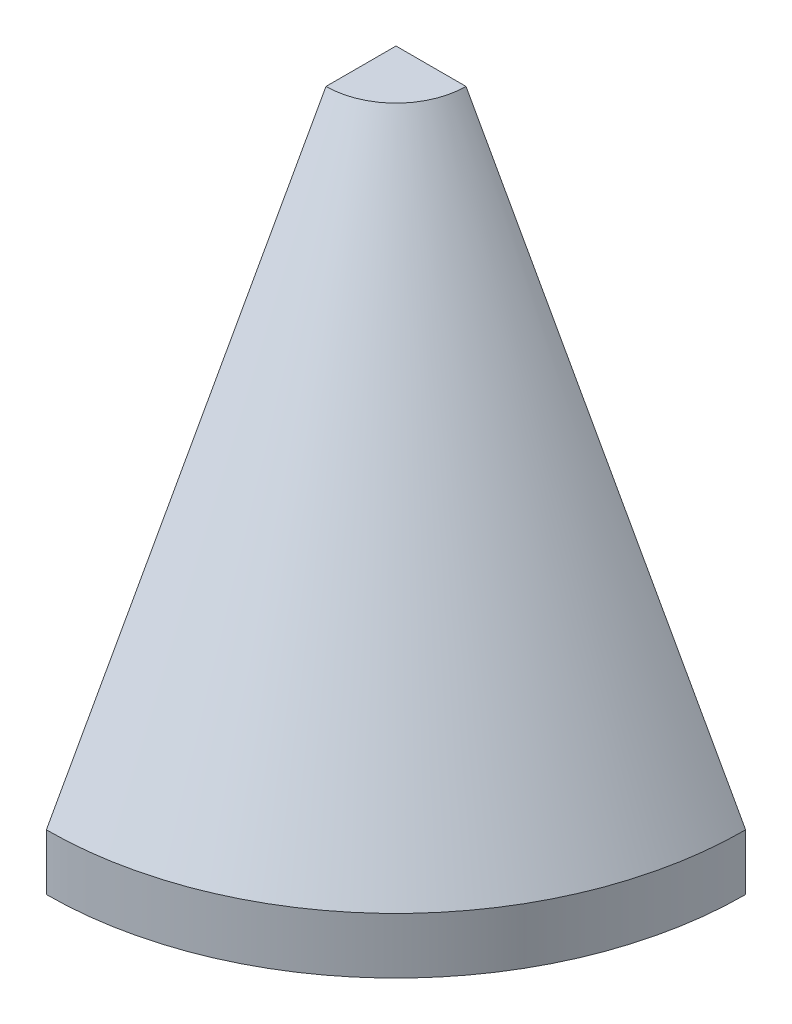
SolidWorks part; units mm, degrees
ref_plane "Front Plane" through (0, 0, 0) normal (0, 0, 1) x (1, 0, 0)
ref_plane "Top Plane" through (0, 0, 0) normal (0, 1, 0) x (1, 0, 0)
ref_plane "Right Plane" through (0, 0, 0) normal (1, 0, 0) x (0, 0, -1)
sketch "Sketch1" plane through (0, 0, 0) normal (0, 0, 1) x (1, 0, 0)
  line L0 (25, 200) -> (124.8798, 20)
  line L1 (0, 0) -> (124.8798, 0)
  line L2 (0, 0) -> (0, 200)
  line L3 (0, 200) -> (25, 200)
  line L4 (124.8798, 0) -> (124.8798, 20)
  dimension "D1" = 124.8798
  dimension "D2" = 20
  dimension "D3" = 25
  dimension "D4" = 200
revolve "Revolve1" add sketch "Sketch1" angle 90 about L2
